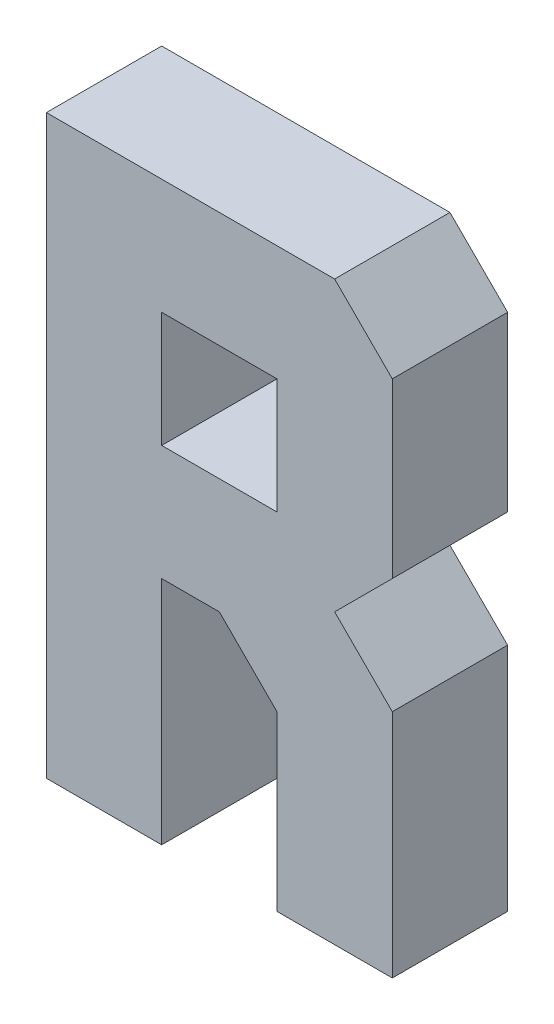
SolidWorks part; units mm, degrees
ref_plane "Plan de face" through (0, 0, 0) normal (0, 0, 1) x (1, 0, 0)
ref_plane "Plan de dessus" through (0, 0, 0) normal (0, 1, 0) x (1, 0, 0)
ref_plane "Plan de droite" through (0, 0, 0) normal (1, 0, 0) x (0, 0, -1)
sketch "Esquisse1" plane through (0, 0, 0) normal (0, 0, 1) x (1, 0, 0)
  line L1 (0, 0) -> (10, 0)
  line L2 (0, 0) -> (0, 50)
  line L3 (0, 50) -> (13.8454, 50)
  line L4 (10, 0) -> (10, 20)
  line L5 (13.8454, 50) -> (30, 50)
  line L6 (10, 40) -> (20, 40)
  line L7 (10, 20) -> (20, 20)
  line L8 (30, 50) -> (30, 30)
  line L9 (10, 40) -> (10, 30)
  line L10 (10, 30) -> (20, 30)
  line L11 (20, 40) -> (20, 30)
  line L12 (30, 0) -> (20, 0)
  line L13 (30, 0) -> (30, 20)
  line L14 (30, 30) -> (25, 30)
  line L15 (20, 0) -> (20, 20)
  line L17 (30, 20) -> (25, 20)
  line L18 (25, 30) -> (25, 20)
  dimension "D1" = 50
  dimension "D2" = 20
  dimension "D3" = 10
  dimension "D4" = 10
  dimension "D5" = 10
  dimension "D6" = 10
  dimension "D7" = 10
  dimension "D8" = 10
  dimension "D9" = 20
  dimension "D10" = 10
  dimension "D11" = 5
  dimension "D12" = 20
extrude "Boss.-Extru.1" add sketch "Esquisse1" along normal blind 10
chamfer "Chanfrein1" distance 5 angle 45 3 edges at (20, 20, 5) (25, 20, 5) (25, 30, 5)
chamfer "Chanfrein2" distance 5 angle 45 1 edges at (30, 50, 5)
